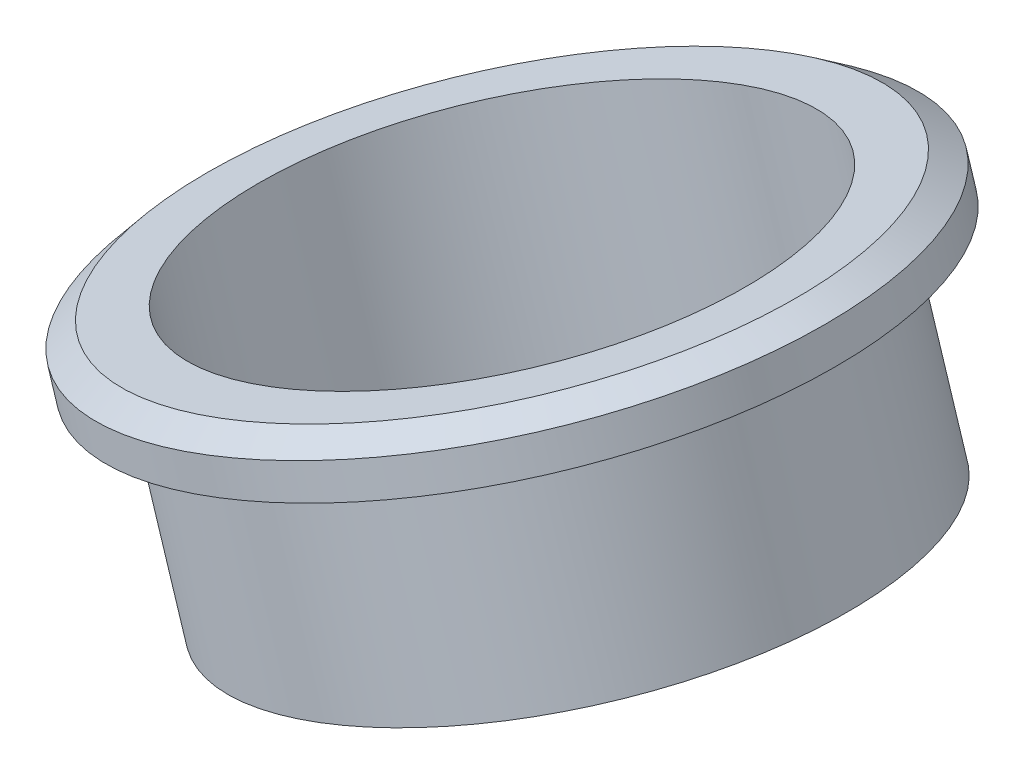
SolidWorks part; units mm, degrees
ref_plane "Alzado" through (0, 0, 0) normal (0, 0, 1) x (1, 0, 0)
ref_plane "Planta" through (0, 0, 0) normal (0, 1, 0) x (1, 0, 0)
ref_plane "Vista lateral" through (0, 0, 0) normal (1, 0, 0) x (0, 0, -1)
sketch "Sk_Cono" plane through (0, 0, 0) normal (0, 0, 1) x (1, 0, 0)
  line L0 (385.5004, 520.0564) -> (387.1217, 520.5676)
  line L1 (387.1217, 520.5676) -> (383.5131, 532.0121)
  line L2 (383.5131, 532.0121) -> (386.3743, 532.9143)
  line L3 (386.3743, 532.9143) -> (385.7729, 534.8217)
  line L4 (385.7729, 534.8217) -> (384.0416, 535.3244)
  line L5 (384.0416, 535.3244) -> (380.9897, 534.3621)
  line L6 (380.9897, 534.3621) -> (385.5004, 520.0564)
  line L7 (364.8943, 534.5297) -> (375.4193, 501.1497) construction
revolve "Cono" add sketch "Sk_Cono" angle 360 about L7
